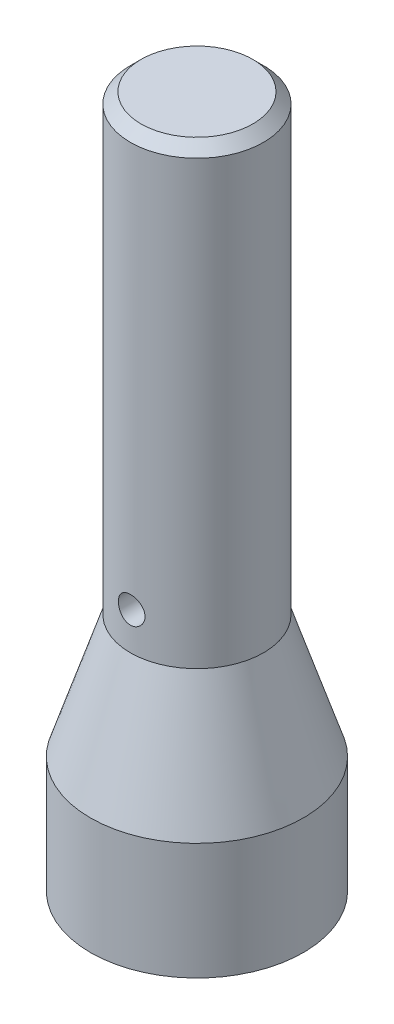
SolidWorks part; units mm, degrees
ref_plane "Front Plane" through (0, 0, 0) normal (0, 0, 1) x (1, 0, 0)
ref_plane "Top Plane" through (0, 0, 0) normal (0, 1, 0) x (1, 0, 0)
ref_plane "Right Plane" through (0, 0, 0) normal (1, 0, 0) x (0, 0, -1)
sketch "Sketch1" plane through (0, 0, 0) normal (0, 1, 0) x (1, 0, 0)
  circle A0 centre (0, 0) radius 2
  dimension "D1" = 4
extrude "Boss-Extrude1" add sketch "Sketch1" along normal blind 4.5
chamfer "Chamfer1" distance 2.31 angle 18 1 edges at (0, 4.5, 2)
sketch "Sketch4" plane through (0, 4.5, 0) normal (0, 1, 0) x (1, 0, 0)
  circle A0 centre (0, 0) radius 1.25
  dimension "D1" = 2.5
extrude "Boss-Extrude2" add sketch "Sketch4" along normal blind 8.5
hole_wizard "Ø1.6 (1.6) Diameter Hole2" positions "Sketch6" profile "Sketch5" hole size "Ø1.6" standard "ISO"
sketch "Sketch6" plane through (0, 0, 0) normal (0, -1, 0) x (-1, 0, 0)
  point P0 (0, 0)
sketch "Sketch5" plane through (0, 0, 0) normal (1, 0, 0) x (0, 0, -1)
  line L0 (0, 0) -> (0, 3.8)
  line L1 (0, 3.8) -> (0.8, 3)
  line L2 (0.8, 3) -> (0.8, 0)
  line L5 (0.8, 0) -> (0, 0)
  line L10 (0, 3.8) -> (-0.8, 3) construction
  line L11 (0, -6.35) -> (0, 107.95) construction
  dimension "Hole Dia." = 1.6
  dimension "Hole Depth" = 3
  dimension "Drill Angle" = 90
hole_wizard "Ø1.0 (1) Diameter Hole1" positions "Sketch8" profile "Sketch7" hole size "Ø1.0" standard "ISO"
sketch "Sketch8" plane through (0, 0, 0) normal (0, -1, 0) x (-1, 0, 0)
  point P0 (0, 0)
sketch "Sketch7" plane through (0, 0, 0) normal (1, 0, 0) x (0, 0, -1)
  line L0 (0, 0) -> (0, 6.5)
  line L1 (0, 6.5) -> (0.5, 6)
  line L2 (0.5, 6) -> (0.5, 0)
  line L5 (0.5, 0) -> (0, 0)
  line L10 (0, 6.5) -> (-0.5, 6) construction
  line L11 (0, -6.35) -> (0, 107.95) construction
  dimension "Hole Dia." = 1
  dimension "Hole Depth" = 6
  dimension "Drill Angle" = 90
hole_wizard "Ø0.5 (0.5) Diameter Hole1" positions "Sketch10" profile "Sketch9" hole size "Ø0.5" standard "ISO"
sketch "Sketch10" plane through (0, 0, 0) normal (0, 0, 1) x (1, 0, 0)
  line L0 (-2, 0) -> (2, 0) construction
  point P0 (0, 5.2)
  dimension "D1" = 5.2
sketch "Sketch9" plane through (0, 5.2, 0) normal (1, 0, 0) x (0, 1, 0)
  line L0 (0, 0) -> (0, 6.25)
  line L1 (0, 6.25) -> (0.25, 6)
  line L2 (0.25, 6) -> (0.25, 0)
  line L5 (0.25, 0) -> (0, 0)
  line L10 (0, 6.25) -> (-0.25, 6) construction
  line L11 (0, -6.35) -> (0, 107.95) construction
  dimension "Hole Dia." = 0.5
  dimension "Hole Depth" = 6
  dimension "Drill Angle" = 90
chamfer "Chamfer2" distance 0.2 angle 45 1 edges at (0, 13, 1.25)
